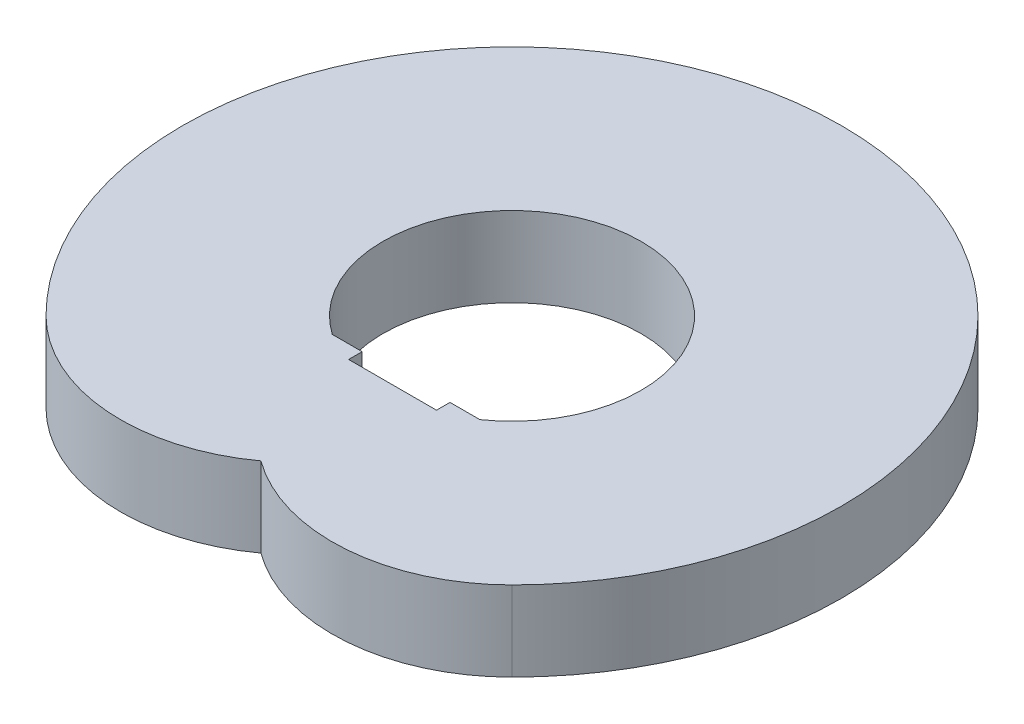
SolidWorks part; units mm, degrees
ref_plane "前视基准面" through (0, 0, 0) normal (0, 0, 1) x (1, 0, 0)
ref_plane "上视基准面" through (0, 0, 0) normal (0, 1, 0) x (1, 0, 0)
ref_plane "右视基准面" through (0, 0, 0) normal (1, 0, 0) x (0, 0, -1)
sketch "草图1" plane through (0, 0, 0) normal (0, 1, 0) x (1, 0, 0)
  line L0 (0, 0) -> (0, 825) construction
  line L1 (0, 0) -> (-583.3631, -583.3631) construction
  line L2 (0, 0) -> (583.3631, -583.3631) construction
  line L3 (0, 375) -> (318.1981, 56.8019) construction
  line L4 (0, 375) -> (-318.1981, 56.8019) construction
  line L5 (-110, -265.165) -> (-110, -299)
  line L6 (184.835, -265.165) -> (110, -265.165)
  line L7 (-110, -299) -> (110, -299)
  line L8 (110, -265.165) -> (110, -299)
  line L9 (-110, -265.165) -> (-184.835, -265.165)
  circle A0 centre (0, 0) radius 375 construction
  circle A1 centre (0, 375) radius 450 construction
  arc A2 (583.3631, -583.3631) -> (-583.3631, -583.3631) centre (0, 0) ccw
  arc A4 (-583.3631, -583.3631) -> (0, -628.741) centre (-265.165, -265.165) ccw
  arc A5 (0, -628.741) -> (583.3631, -583.3631) centre (265.165, -265.165) ccw
  arc A7 (184.835, -265.165) -> (-184.835, -265.165) centre (0, 0) ccw
  point P19 (0, -299)
  dimension "D1" = 750
  dimension "D2" = 900
  dimension "D4" = 135
  dimension "D3" = 825
  dimension "D8" = 299
  dimension "D5" = 135
  dimension "D6" = 135
  dimension "D7" = 135
  dimension "D9" = 220
extrude "凸台-拉伸1" add sketch "草图1" along normal blind 200
